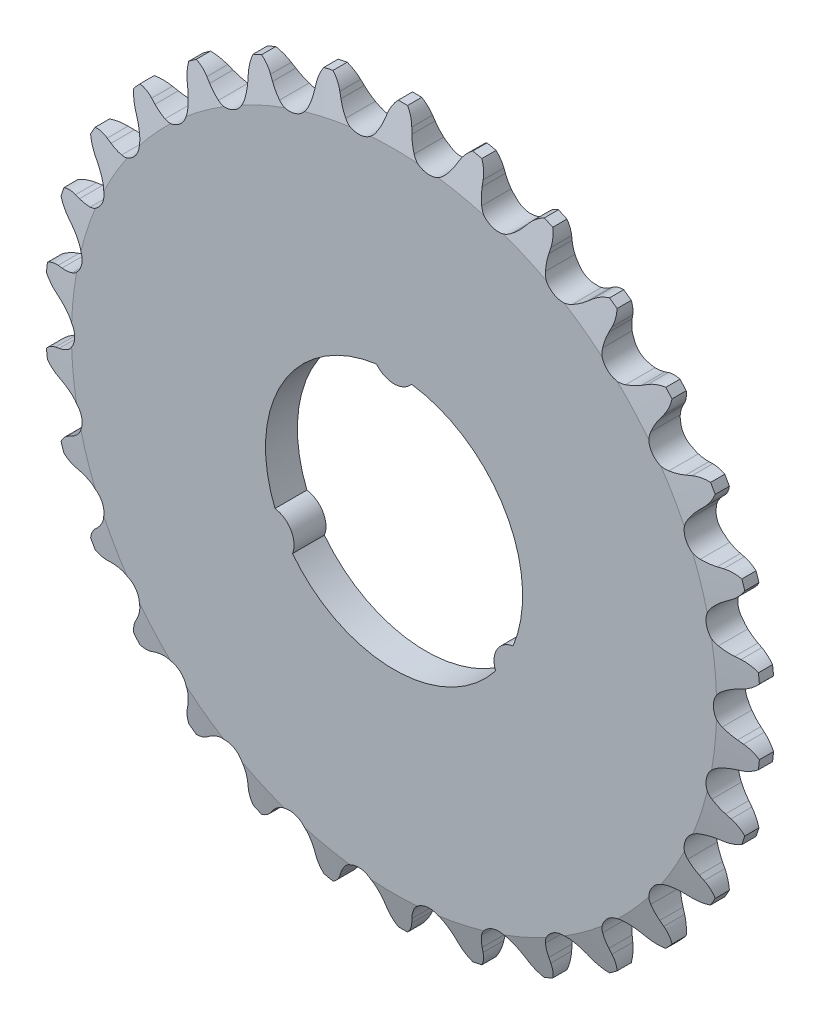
SolidWorks part; units mm, degrees
ref_plane "Front Plane" through (0, 0, 0) normal (0, 0, 1) x (1, 0, 0)
ref_plane "Top Plane" through (0, 0, 0) normal (0, 1, 0) x (1, 0, 0)
ref_plane "Right Plane" through (0, 0, 0) normal (1, 0, 0) x (0, 0, -1)
sketch "Sketch0" plane through (0, 0, 0) normal (0, 0, 1) x (1, 0, 0)
  line L0 (4.7625, -45.3122) -> (0, 0) construction
  line L1 (0, 0) -> (14.0794, -43.3318) construction
  line L2 (0, 0) -> (-4.7625, -45.3122) construction
  line L3 (4.7625, -45.3122) -> (14.0794, -43.3318) construction
  line L4 (4.7625, -45.3122) -> (-4.7625, -45.3122) construction
  line L5 (8.041, -45.6968) -> (7.7268, -45.0764)
  line L6 (4.7625, -45.3122) -> (0, -45.8127) construction
  line L7 (1.6356, -46.37) -> (1.814, -45.6978)
  line L8 (0, -45.3122) -> (0, -48.1697) construction
  line L9 (6.6573, -43.5452) -> (1.7903, -48.0838) construction
  line L10 (0, 0) -> (0, -45.3122) construction
  line L11 (7.7268, -45.0764) -> (1.7903, -48.0838) construction
  line L12 (0, -48.1697) -> (0, -48.7003) construction
  line L13 (11.7191, -43.8335) -> (8.041, -45.6968) construction
  circle A0 centre (0, 0) radius 48.1697 construction
  circle A1 centre (0, 0) radius 45.5618 construction
  arc A2 (-2.563, -49.4297) -> (12.784, -47.8167) centre (0, 0) ccw
  circle A3 centre (0, 0) radius 48.7003 construction
  circle A4 centre (4.7625, -45.3122) radius 2.54 construction
  arc A7 (6.6573, -43.5452) -> (2.5418, -43.9778) centre (4.7625, -45.3122) ccw
  circle A8 centre (4.7625, -45.3122) radius 2.5908 construction
  arc A9 (8.041, -45.6968) -> (12.784, -47.8167) centre (11.7191, -43.8335) ccw
  arc A10 (7.7268, -45.0764) -> (6.6573, -43.5452) centre (1.7903, -48.0838) ccw
  arc A11 (1.6356, -46.37) -> (-2.563, -49.4297) centre (-2.3495, -45.3122) cw
  arc A12 (1.814, -45.6978) -> (2.5418, -43.9778) centre (8.246, -47.4053) cw
  dimension "D1" = 2.5908
  dimension "Dr" = 5.08
  dimension "Ds" = 5.1816
  dimension "R" = 2.5908
  dimension "Pitch" = 9.525
  dimension "A" = 37
  dimension "360/N" = 12
  dimension "B" = 16.133
  dimension "ab" = 7.112
  dimension "J" = 2.8575
  dimension "ac" = 4.064
sketch "Sketch1" plane through (0, 0, 0) normal (1, 0, 0) x (0, 0, -1)
  line L0 (2.1463, 0) -> (-2.1463, 0)
  line L1 (-2.1463, 0) -> (-2.1463, 43.4072)
  line L2 (-2.1463, 43.4072) -> (-0.9557, 48.1697)
  line L3 (-0.9557, 48.1697) -> (0.9557, 48.1697)
  line L4 (0.9557, 48.1697) -> (2.1463, 43.4072)
  line L5 (2.1463, 43.4072) -> (2.1463, 0)
  line L7 (0, 48.1697) -> (0, 0) construction
  line L8 (-2.1463, 43.4072) -> (2.1463, 43.4072) construction
  line L9 (0, 48.1697) -> (0, -48.1697) construction
  line L10 (-2.1463, 43.4072) -> (-2.1463, 48.1697) construction
  line L11 (-2.1463, 48.1697) -> (-0.9557, 48.1697) construction
  line L12 (0.9557, 48.1697) -> (2.1463, 48.1697) construction
  line L13 (2.1463, 48.1697) -> (2.1463, 43.4072) construction
  line L14 (0, 0) -> (-6.4008, 0) construction
  line L22 (2.1463, 0) -> (-20.0787, 0) construction
  line L24 (-2.1463, 0) -> (-2.1463, 40.1687) construction
  dimension "t" = 4.2926
  dimension "g" = 1.1906
  dimension "h" = 4.7625
  dimension "K" = 6.4008
  dimension "MHD" = 80.3373
  dimension "Width" = 22.225
revolve "Revolve1" add sketch "Sketch1" angle 360 mid plane about L0
extrude "Cut-Extrude1" cut sketch "Sketch0" against normal through all and the other way through all
pattern_circular "CirPattern1" count 30 over 360 about axis through (0, 0, 0) along (0, 0, 1) of "Cut-Extrude1"
sketch "Sketch2" plane through (0, 0, 0) normal (0, 0, 1) x (1, 0, 0)
  circle A0 centre (0, 0) radius 6.35 construction
  circle A1 centre (0, 0) radius 25.4
  circle A2 centre (0, 0) radius 48.133 construction
  dimension "Bore" = 12.7
  dimension "Hub Dia." = 50.8
  dimension "OD" = 96.266
extrude "Boss-Extrude1" add sketch "Sketch2" along normal up to vertex (20.0787 mm away) from surface at 2.1463
sketch "Sketch3" plane through (0, 0, 0) normal (0, 0, 1) x (1, 0, 0)
  circle A0 centre (0, 0) radius 6.35 construction
  circle A1 centre (0, 0) radius 6.35
extrude "Cut-Extrude2" cut sketch "Sketch3" along normal through all and the other way through all
sketch "Sketch4" plane through (0, 0, 0) normal (1, 0, 0) x (0, 0, -1)
  line L0 (-20.0787, 25.4) -> (-20.0787, 24.765)
  line L1 (-2.1463, 48.1697) -> (-5.3658, 48.1697)
  line L2 (-2.1463, 48.1697) -> (-2.1463, 40.1687)
  line L3 (-2.1463, 40.1687) -> (-5.3658, 40.1687)
  line L4 (-5.3658, 48.1697) -> (-5.3658, 40.1687)
  line L9 (-20.0787, 24.765) -> (-19.4437, 25.4)
  line L10 (-19.4437, 25.4) -> (-20.0787, 25.4)
  dimension "C" = 0.635
  dimension "D3" = 3.2195
revolve "Cut-Revolve1" cut sketch "Sketch4" angle 360 mid plane about L22
sketch "Sketch5" plane through (0, 0, -2.1463) normal (0, 0, -1) x (-1, 0, 0)
  arc A0 (-13.6652, -10.6091) -> (13.6677, -10.6059) centre (0, 0) ccw
  arc A1 (-2.3532, 17.1392) -> (2.3532, 17.1392) centre (0, 19) ccw
  circle A2 centre (0, 0) radius 22 construction
  arc A3 (16.0199, -6.531) -> (13.6677, -10.6059) centre (16.456, -9.4992) ccw
  arc A4 (-13.6652, -10.6091) -> (-16.0193, -6.5324) centre (-16.453, -9.5009) ccw
  arc A5 (19.0132, -11.0678) -> (19.0934, -10.929) centre (16.456, -9.4992) ccw
  arc A6 (16.0199, -6.531) -> (2.3532, 17.1392) centre (0, 0) ccw
  arc A7 (-2.3532, 17.1392) -> (-16.0193, -6.5324) centre (0, 0) ccw
  point P13 (0.001, 0)
  dimension "D1" = 34.6
  dimension "D2" = 44
  dimension "D3" = 6
  dimension "D4" = 3
extrude "Cut-Extrude3" cut sketch "Sketch5" against normal through all contours A1 A7 A4 A0 A3 A6
sketch "Sketch6" plane through (0, 0, 2.1463) normal (0, 0, 1) x (1, 0, 0)
  circle A0 centre (0, 0) radius 35.1167
extrude "Cut-Extrude5" cut sketch "Sketch6" along normal up to surface (17.9324 mm away)
equation "\"360/N@Sketch0\" = 360/\"Teeth@CirPattern1\""
equation "\"Ds@Sketch0\" = 1.005 * \"Dr@Sketch0\" + 0.003"
equation "\"R@Sketch0\" = 1/2 * \"Ds@Sketch0\""
equation "\"A@Sketch0\" = 35 +  ( 60 / \"Teeth@CirPattern1\" ) "
equation "\"B@Sketch0\" = 18 -  ( 56 / \"Teeth@CirPattern1\" )"
equation "\"ac@Sketch0\" = 0.8 * \"Dr@Sketch0\""
equation "\"ab@Sketch0\" = 1.4 * \"Dr@Sketch0\""
equation "\"J@Sketch0\" = 0.3 * \"Pitch@Sketch0\""
equation "\"h@Sketch1\" = \"Pitch@Sketch0\" / 2"
equation "\"g@Sketch1\" = \"h@Sketch1\" / 4"
equation "\"MHD@Sketch1\" = \"Pitch@Sketch0\" * ( cotan ( 180 / \"Teeth@CirPattern1\" ) - 1 ) - 0.030"
equation "\"D3@Sketch4\" = \"t@Sketch1\" * 3 / 4"
